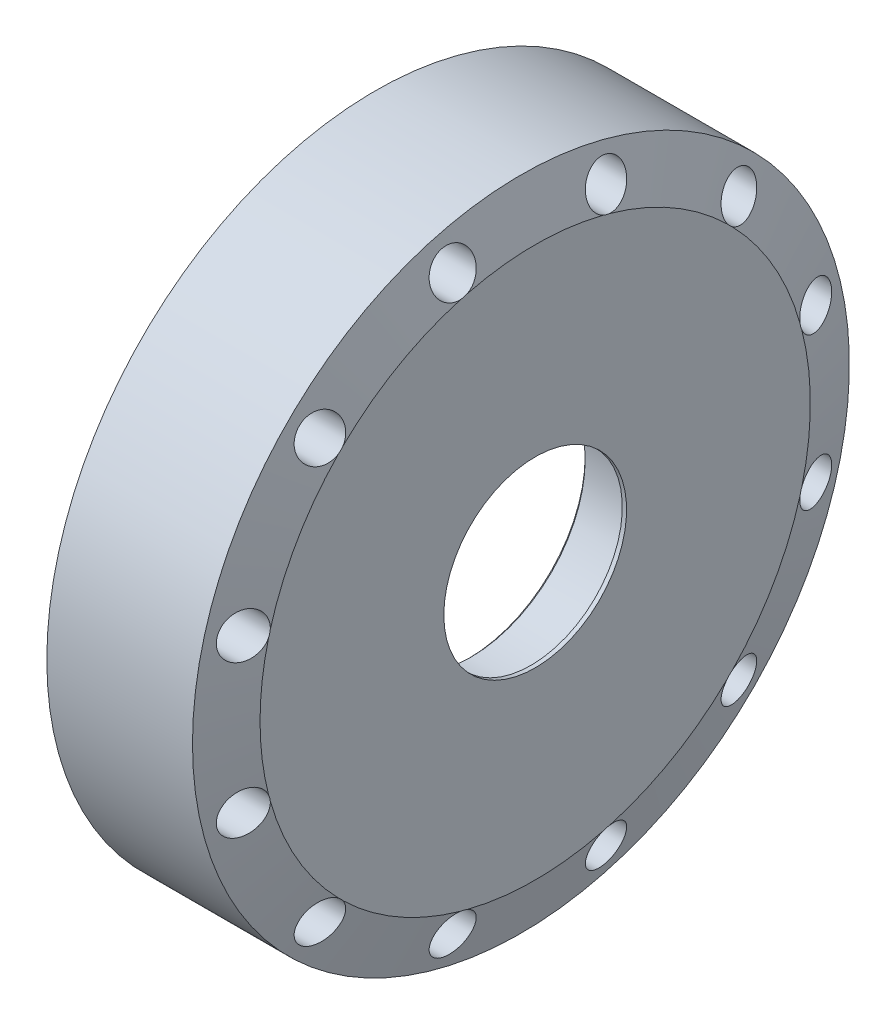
SolidWorks part; units mm, degrees
ref_plane "Face" through (0, 0, 0) normal (0, 0, 1) x (1, 0, 0)
ref_plane "Dessus" through (0, 0, 0) normal (0, 1, 0) x (1, 0, 0)
ref_plane "Droite" through (0, 0, 0) normal (1, 0, 0) x (0, 0, -1)
sketch "Esquisse1" plane through (0, 0, 0) normal (0, 0, 1) x (1, 0, 0)
  line L0 (0, 0) -> (52.3326, 0) construction
  line L1 (0, 222.5) -> (0, 230)
  line L2 (0, 230) -> (102, 230)
  line L3 (102, 230) -> (112, 192.6795)
  line L4 (112, 192.6795) -> (112, 64)
  line L5 (112, 64) -> (109, 64)
  line L6 (109, 64) -> (109, 72.5)
  line L7 (109, 72.5) -> (105, 72.5)
  line L8 (65, 80) -> (65, 196.5)
  line L9 (65, 196.5) -> (7, 196.5)
  line L11 (65, 80) -> (105, 80)
  line L12 (7, 196.5) -> (7, 222.5)
  line L13 (7, 222.5) -> (0, 222.5)
  line L16 (105, 80) -> (105, 72.5)
  dimension "D1" = 460
  dimension "D2" = 7
  dimension "D3" = 445
  dimension "D4" = 393
  dimension "D5" = 145
  dimension "D6" = 128
  dimension "D7" = 112
  dimension "D8" = 15
  dimension "D9" = 10
  dimension "D10" = 65
  dimension "D11" = 160
  dimension "D12" = 40
  dimension "D13" = 4
revolve "Révolution1" add sketch "Esquisse1" angle 360 about L0
sketch "Esquisse2" plane through (7, 0, 0) normal (-1, 0, 0) x (0, 0, 1)
  line L0 (193.5974, -88.6795) -> (169.792, -74.9354)
  line L1 (-12, 220) -> (12, 220)
  line L2 (-20, 212) -> (-20, 184.5119)
  line L3 (-20, 184.5119) -> (20, 184.5119)
  line L4 (20, 212) -> (20, 184.5119)
  line L5 (196.5256, -99.6077) -> (184.5256, -120.3923)
  line L6 (173.5974, -123.3205) -> (149.792, -109.5765)
  line L7 (169.792, -74.9354) -> (149.792, -109.5765)
  line L8 (-173.5974, -123.3205) -> (-149.792, -109.5765)
  line L9 (-184.5256, -120.3923) -> (-196.5256, -99.6077)
  line L10 (-193.5974, -88.6795) -> (-169.792, -74.9354)
  line L11 (-149.792, -109.5765) -> (-169.792, -74.9354)
  circle A0 centre (0, 0) radius 80 construction
  circle A1 centre (0, 0) radius 80 construction
  arc A2 (12, 220) -> (20, 212) centre (12, 212) cw
  arc A3 (-20, 212) -> (-12, 220) centre (-12, 212) cw
  arc A4 (193.5974, -88.6795) -> (196.5256, -99.6077) centre (189.5974, -95.6077) cw
  arc A5 (184.5256, -120.3923) -> (173.5974, -123.3205) centre (177.5974, -116.3923) cw
  arc A6 (-173.5974, -123.3205) -> (-184.5256, -120.3923) centre (-177.5974, -116.3923) cw
  arc A7 (-196.5256, -99.6077) -> (-193.5974, -88.6795) centre (-189.5974, -95.6077) cw
  point P10 (20, 220)
  point P13 (-20, 220)
  dimension "D4" = 8
  dimension "D1" = 220
  dimension "D2" = 40
  dimension "D3" = 20
extrude "Enlèv. mat.-Extru.1" cut sketch "Esquisse2" against normal blind 40
sketch "Esquisse3" plane through (65, 0, 0) normal (-1, 0, 0) x (0, 0, 1)
  line L0 (0, 0) -> (0, 186.348) construction
  circle A0 centre (0, 155) radius 37.5
  circle A1 centre (0, 0) radius 80 construction
  dimension "D1" = 75
  dimension "D2" = 155
extrude "Enlèv. mat.-Extru.2" cut sketch "Esquisse3" against normal blind 37
chamfer "Chanfrein1" distance 2 angle 30 1 edges at (65, 155, 37.5)
sketch "Esquisse4" plane through (65, 0, 0) normal (-1, 0, 0) x (0, 0, 1)
  line L0 (0, 0) -> (0, 135.7142) construction
  circle A0 centre (0, 95) radius 9.5
  circle A1 centre (0, 0) radius 72.5 construction
  dimension "D1" = 19
  dimension "D2" = 95
extrude "Enlèv. mat.-Extru.3" cut sketch "Esquisse4" against normal blind 1.8
sketch "Esquisse5" plane through (65, 0, 0) normal (-1, 0, 0) x (0, 0, 1)
  line L0 (0, 95) -> (101.8609, 95) construction
  line L1 (0, 95) -> (0, 177.5605) construction
ref_plane "Plan1" through (-24.8862, 43.1042, 0) normal (0.5, -0.866, 0) x (0, 0, 1)
sketch "Esquisse7" plane through (-24.8862, 43.1042, 0) normal (0.5, -0.866, 0) x (0, 0, 1)
  line L0 (0, -103.7917) -> (0, -225.7952) construction
  line L1 (3, -98.241) -> (3, -150.0596)
  line L2 (3, -150.0596) -> (0, -151.7917)
  line L3 (3, -98.241) -> (0, -98.241)
  line L4 (0, -103.7917) -> (0, -85.7891) construction
  line L5 (0, -98.241) -> (0, -151.7917)
  dimension "D1" = 3
  dimension "D2" = 120
  dimension "D3" = 48
revolve "Enlèvement de matière-Révolution1" cut sketch "Esquisse7" angle 360 about L4
hole_wizard "Trou taraudé M81" positions "Esquisse9" profile "Esquisse8" tap size "M8" standard "ISO"
sketch "Esquisse9" plane through (65, 0, 0) normal (-1, 0, 0) x (0, 0, 1)
  circle A0 centre (0, 155) radius 38.6547 construction
  point P0 (43, 135)
  dimension "D1" = 20
  dimension "D2" = 43
sketch "Esquisse8" plane through (65, 135, 43) normal (0, 1, 0) x (0, 0, 1)
  line L0 (0, 0) -> (0, 32.0429)
  line L1 (0, 32.0429) -> (3.4, 30)
  line L2 (3.4, 30) -> (3.4, 0)
  line L5 (3.4, 0) -> (0, 0)
  line L10 (0, 32.0429) -> (-3.4, 30) construction
  line L11 (0, -6.35) -> (0, 107.95) construction
  dimension "Diamètre du trou pour taraudage" = 6.8
  dimension "Profondeur du trou pour taraudage" = 30
  dimension "Angle de pointe" = 118
pattern_linear "Répétition linéaire1" count 2 spacing 86 along (0, 0, -1) count 2 spacing 40 along (0, 1, 0) of "Trou taraudé M81"
chamfer "Chanfrein2" distance 2 angle 45 1 edges at (65, 0, 80)
chamfer "Chanfrein3" distance 2.5 angle 30 1 edges at (0, 0, 222.5)
sketch "Esquisse10" plane through (65, 0, 0) normal (-1, 0, 0) x (0, 0, 1)
  line L0 (0, 0) -> (63.6985, 237.7262) construction
  line L1 (0, 0) -> (-62.8215, 234.453) construction
  line L2 (0, 95) -> (0, 177.5605) construction
  dimension "D1" = 15
  dimension "D2" = 15
hole_wizard "Trou taraudé M82" positions "Esquisse12" profile "Esquisse11" tap size "M8" standard "ISO"
sketch "Esquisse12" plane through (65, 0, 0) normal (-1, 0, 0) x (0, 0, 1)
  line L0 (0, 0) -> (-62.8215, 234.453) construction
  point P0 (-24.5878, 91.763)
  dimension "D1" = 95
sketch "Esquisse11" plane through (65, 91.763, -24.5878) normal (0, 1, 0) x (0, 0, 1)
  line L0 (0, 0) -> (0, 32.0429)
  line L1 (0, 32.0429) -> (3.4, 30)
  line L2 (3.4, 30) -> (3.4, 0)
  line L5 (3.4, 0) -> (0, 0)
  line L10 (0, 32.0429) -> (-3.4, 30) construction
  line L11 (0, -6.35) -> (0, 107.95) construction
  dimension "Diamètre du trou pour taraudage" = 6.8
  dimension "Profondeur du trou pour taraudage" = 30
  dimension "Angle de pointe" = 118
hole_wizard "Trou taraudé M83" positions "Esquisse14" profile "Esquisse13" tap size "M8" standard "ISO"
sketch "Esquisse14" plane through (65, 0, 0) normal (-1, 0, 0) x (0, 0, 1)
  line L0 (0, 0) -> (63.6985, 237.7262) construction
  point P0 (24.5878, 91.763)
  dimension "D1" = 95
sketch "Esquisse13" plane through (65, 91.763, 24.5878) normal (0, 1, 0) x (0, 0, 1)
  line L0 (0, 0) -> (0, 32.0429)
  line L1 (0, 32.0429) -> (3.4, 30)
  line L2 (3.4, 30) -> (3.4, 0)
  line L5 (3.4, 0) -> (0, 0)
  line L10 (0, 32.0429) -> (-3.4, 30) construction
  line L11 (0, -6.35) -> (0, 107.95) construction
  dimension "Diamètre du trou pour taraudage" = 6.8
  dimension "Profondeur du trou pour taraudage" = 30
  dimension "Angle de pointe" = 118
pattern_circular "Répétition circulaire1" count 6 over 360 about axis through (0, 0, 0) along (1, 0, 0) of "Trou taraudé M81", "Répétition linéaire1", "Enlèvement de matière-Révolution1", "Enlèv. mat.-Extru.3", "Enlèv. mat.-Extru.2", "Chanfrein1", "Trou taraudé M82", "Trou taraudé M83"
hole_wizard "Chambrage pour vis à tête hexagonale M161" positions "Esquisse16" profile "Esquisse15" counterbore size "M16" standard "ISO"
sketch "Esquisse16" plane through (112, 0, 0) normal (1, 0, 0) x (0, 0, -1)
  line L0 (0, 0) -> (62.8215, 234.453) construction
  point P0 (53.705, 200.4296)
  dimension "D1" = 207.5
sketch "Esquisse15" plane through (112, 200.4296, -53.705) normal (0, 1, 0) x (0, 0, -1)
  line L0 (0, 0) -> (0, 112)
  line L1 (0, 112) -> (9, 112)
  line L3 (9, 112) -> (9, 45)
  line L4 (9, 45) -> (15, 45)
  line L5 (15, 45) -> (15, 0)
  line L7 (15, 0) -> (0, 0)
  line L11 (0, -6.35) -> (0, 107.95) construction
  dimension "Diamètre du perçage jusqu'au prochain" = 18
  dimension "Profondeur du perçage jusqu'au prochain" = 112
  dimension "Diamètre du chambrage" = 30
  dimension "Profondeur du chambrage" = 45
pattern_circular "Répétition circulaire2" count 12 over 360 about axis through (0, 0, 0) along (1, 0, 0) of "Chambrage pour vis à tête hexagonale M161"
